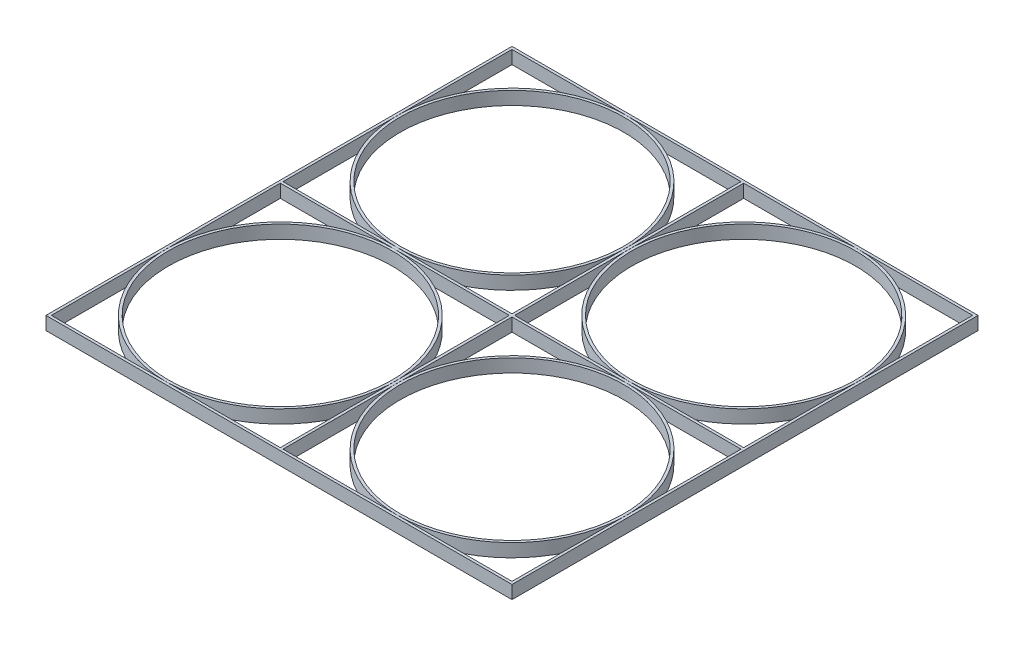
SolidWorks part; units mm, degrees
ref_plane "Front Plane" through (0, 0, 0) normal (0, 0, 1) x (1, 0, 0)
ref_plane "Top Plane" through (0, 0, 0) normal (0, 1, 0) x (1, 0, 0)
ref_plane "Right Plane" through (0, 0, 0) normal (1, 0, 0) x (0, 0, -1)
sketch "Sketch1" plane through (0, 0, 0) normal (0, 1, 0) x (1, 0, 0)
  line L1 (-43.875, 43.875) -> (43.875, 43.875)
  line L2 (-43.875, 43.875) -> (-43.875, -43.875)
  line L3 (-43.875, -43.875) -> (43.875, -43.875)
  line L4 (43.875, 43.875) -> (43.875, -43.875)
  line L5 (-43.875, 43.875) -> (43.875, -43.875) construction
  line L6 (-43.875, -43.875) -> (43.875, 43.875) construction
  line L7 (-43.375, 43.375) -> (43.375, 43.375)
  line L8 (-43.375, 43.375) -> (-43.375, -43.375)
  line L9 (-43.375, -43.375) -> (43.375, -43.375)
  line L10 (43.375, 43.375) -> (43.375, -43.375)
  line L11 (-43.375, 43.375) -> (43.375, -43.375) construction
  line L12 (-43.375, -43.375) -> (43.375, 43.375) construction
  point P0 (0, 0)
  point P6 (0, 0)
  dimension "D1" = 87.75
  dimension "D2" = 0.5
extrude "Boss-Extrude1" add sketch "Sketch1" along normal blind 5
sketch "Sketch2" plane through (0, 0, 0) normal (0, 1, 0) x (1, 0, 0)
  line L0 (-43.375, 43.375) -> (-43.375, -43.375) construction
  line L1 (43.375, -43.375) -> (43.375, 43.375) construction
  circle A0 centre (0, 0) radius 43.375
  circle A1 centre (0, 0) radius 42.375
  dimension "D1" = 1
extrude "Boss-Extrude2" add sketch "Sketch2" along normal blind 5 separate body
pattern_linear "LPattern2" count 2 spacing 87.75 along (1, 0, 0)
pattern_linear "LPattern3" count 2 spacing 87.75 along (0, 0, 1)
sketch "Sketch3" plane through (0, 0, 0) normal (0, 1, 0) x (1, 0, 0)
  line L0 (-43.875, -131.625) -> (43.875, -131.625) construction
  line L1 (-43.875, 43.875) -> (131.625, 43.875)
  line L2 (-43.875, 43.875) -> (-43.875, -131.625)
  line L3 (-43.875, -131.625) -> (131.625, -131.625)
  line L4 (131.625, 43.875) -> (131.625, -131.625)
  line L6 (131.625, -43.875) -> (131.625, 43.875) construction
  line L7 (43.875, 43.875) -> (-43.875, 43.875) construction
extrude "Extrude-Thin1" add sketch "Sketch3" along normal blind 5 thin
